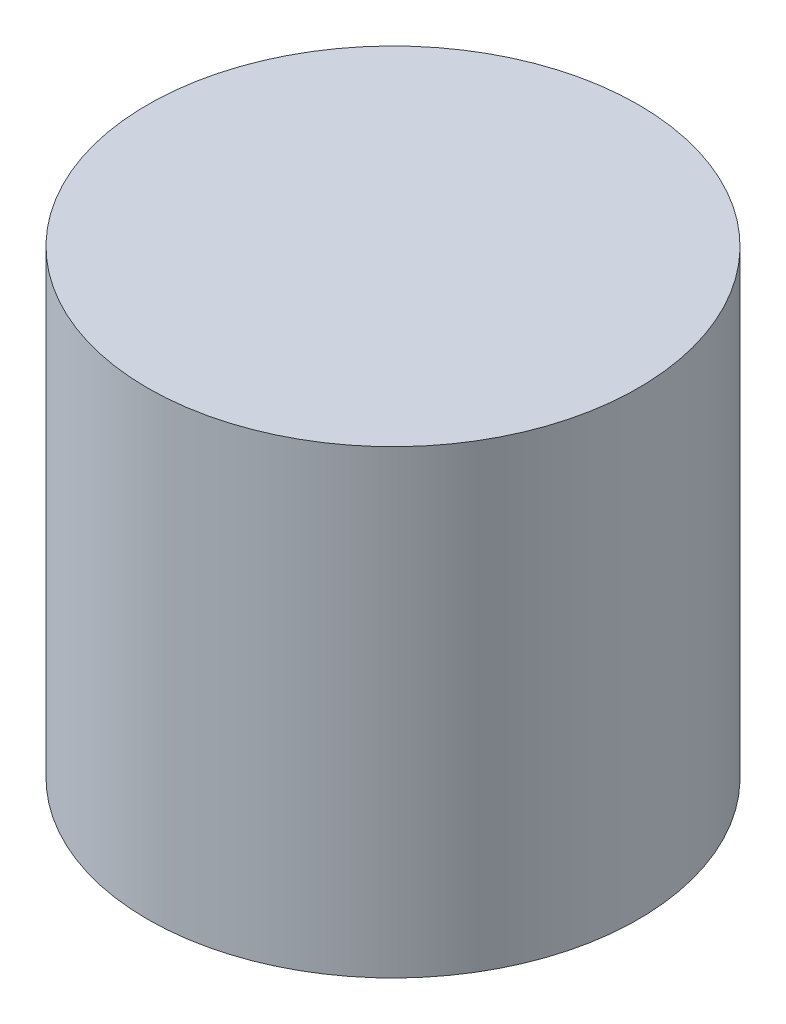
SolidWorks part; units mm, degrees
ref_plane "Front Plane" through (0, 0, 0) normal (0, 0, 1) x (1, 0, 0)
ref_plane "Top Plane" through (0, 0, 0) normal (0, 1, 0) x (1, 0, 0)
ref_plane "Right Plane" through (0, 0, 0) normal (1, 0, 0) x (0, 0, -1)
sketch "Sketch1" plane through (0, 0, 0) normal (0, 0, 1) x (1, 0, 0)
  line L0 (0, 0) -> (0, 24826.1782) construction
  line L1 (0, 13) -> (4, 13)
  line L2 (4, 13) -> (4, 0)
  line L3 (4, 0) -> (8, 0)
  line L4 (8, 0) -> (8, 15)
  line L5 (8, 15) -> (0, 15)
  line L6 (0, 13) -> (0, 15)
  dimension "D1" = 8
  dimension "D2" = 15
  dimension "D3" = 13
  dimension "D4" = 4
revolve "Revolve1" add sketch "Sketch1" angle 360 about L0
